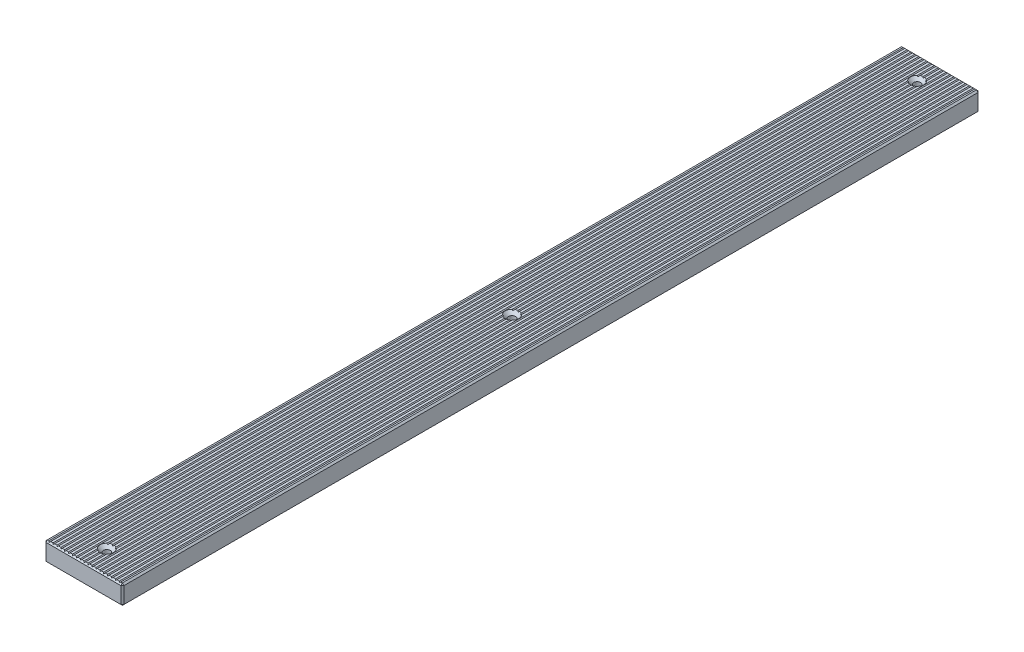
SolidWorks part; units mm, degrees
ref_plane "Plan de face" through (0, 0, 0) normal (0, 0, 1) x (1, 0, 0)
ref_plane "Plan de dessus" through (0, 0, 0) normal (0, 1, 0) x (1, 0, 0)
ref_plane "Plan de droite" through (0, 0, 0) normal (1, 0, 0) x (0, 0, -1)
sketch "Esquisse1" plane through (0, 0, 0) normal (0, 0, 1) x (1, 0, 0)
  line L0 (50, -12.5) -> (-50, 12.5) construction
  line L2 (50, -12.5) -> (-50, -12.5)
  line L3 (50, -12.5) -> (50, 12.5)
  line L4 (50, 12.5) -> (-50, 12.5)
  line L5 (-50, -12.5) -> (-50, 12.5)
  dimension "D1" = 25
  dimension "D2" = 100
extrude "Boss.-Extru.1" add sketch "Esquisse1" along normal mid plane 1100
chamfer "Chanfrein1" distance 2 angle 45 12 edges at (-50, 0, -550) (50, 0, -550) (-50, -12.5, 0) (0, -12.5, -550) (50, -12.5, 0) (0, -12.5, 550) (-50, 0, 550) (50, 0, 550) (50, 12.5, 0) (0, 12.5, 550) (-50, 12.5, 0) (0, 12.5, -550)
sketch "Esquisse2" plane through (0, 0, 550) normal (0, 0, 1) x (1, 0, 0)
  line L0 (-45, 25.2323) -> (-45, -21.4574) construction
  line L1 (-48, 12.5) -> (48, 12.5) construction
  line L2 (-46, 12.5) -> (-44, 12.5)
  line L3 (-46, 12.5) -> (-45, 11.5)
  line L4 (-45, 11.5) -> (-44, 12.5)
  dimension "D1" = 90
  dimension "D2" = 1
  dimension "D3" = 45
extrude "Enlèv. mat.-Extru.1" cut sketch "Esquisse2" against normal through all
pattern_linear "Répétition linéaire1" count 19 spacing 5 along (1, 0, 0) of "Enlèv. mat.-Extru.1"
hole_wizard "Fraisage pour vis à tête fraisée M81" positions "Esquisse4" profile "Esquisse3" countersink size "M8" standard "ISO"
sketch "Esquisse4" plane through (0, 12.5, 0) normal (0, 1, 0) x (-1, 0, 0)
  line L0 (48, -550) -> (-48, -550) construction
  line L2 (0, -598.1763) -> (0, 635.096) construction
  line L3 (0, -549) -> (0, 549) construction
  line L6 (-48, 550) -> (48, 550) construction
  point P0 (0, -520)
  point P19 (0, 0)
  point P21 (0, 520)
  dimension "D1" = 30
  dimension "D2" = 30
sketch "Esquisse3" plane through (0, 12.5, -520) normal (1, 0, 0) x (0, 0, 1)
  line L0 (0, 0) -> (0, 25)
  line L1 (0, 25) -> (4.5, 25)
  line L2 (4.5, 25) -> (4.5, 4.15)
  line L3 (4.5, 4.15) -> (8.65, 0)
  line L5 (8.65, 0) -> (0, 0)
  line L6 (-4.5, 4.15) -> (-8.65, 0) construction
  line L11 (0, -6.35) -> (0, 107.95) construction
  dimension "Diamètre du perçage jusqu'au prochain" = 9
  dimension "Profondeur du perçage jusqu'au prochain" = 25
  dimension "Diamètre du fraisage entrant" = 17.3
  dimension "Angle du fraisage entrant" = 90
